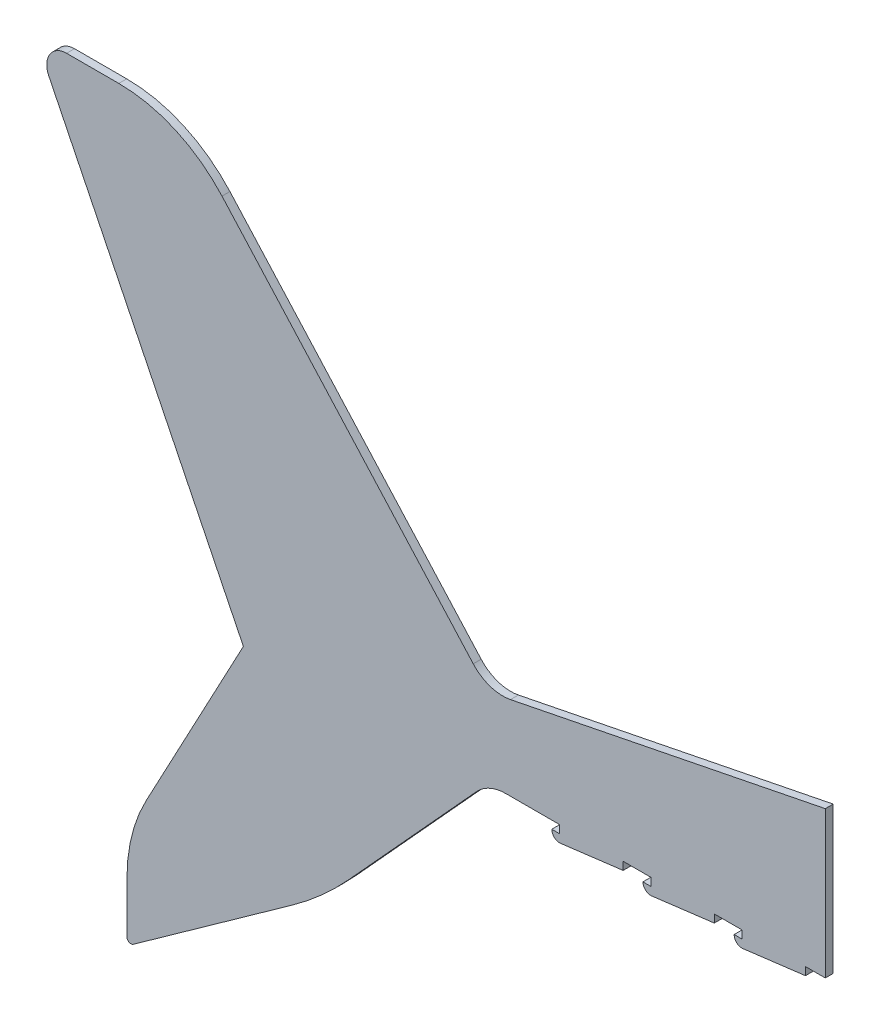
SolidWorks part; units mm, degrees
ref_plane "Front Plane" through (0, 0, 0) normal (0, 0, 1) x (1, 0, 0)
ref_plane "Top Plane" through (0, 0, 0) normal (0, 1, 0) x (1, 0, 0)
ref_plane "Right Plane" through (0, 0, 0) normal (1, 0, 0) x (0, 0, -1)
sketch "Sketch1" plane through (0, 0, 0) normal (0, 0, 1) x (1, 0, 0)
  line L0 (0, 0) -> (-85, 0)
  line L1 (0, 0) -> (0, 37)
  line L2 (0, 37) -> (-85, 20)
  line L4 (-85, 0) -> (-126.771, -45.8169)
  line L5 (-126.771, -45.8169) -> (-176.1556, -81.0577)
  line L6 (-176.1556, -81.0577) -> (-176.1556, -55.9797)
  line L7 (-176.1556, -55.9797) -> (-146.7875, -0.9545)
  line L8 (-146.7875, -0.9545) -> (-199.4076, 106.3241)
  line L9 (-199.4076, 106.3241) -> (-162.6163, 106.3241)
  line L10 (-162.6163, 106.3241) -> (-85, 20)
  dimension "D1" = 85
  dimension "D2" = 37
  dimension "D3" = 20
  dimension "D4" = 62
  dimension "D5" = 126.771
  dimension "D6" = 146.7875
  dimension "D7" = 162.6163
  dimension "D8" = 176.1556
  dimension "D9" = 199.4076
  dimension "D10" = 106.3241
  dimension "D11" = 0.9545
  dimension "D12" = 55.9797
  dimension "D13" = 81.0577
extrude "Boss-Extrude1" add sketch "Sketch1" along normal blind 2
fillet "Fillet1" radius 10 2 edges at (-85, 0, 1) (-85, 20, 1)
fillet "Fillet2" radius 90 1 edges at (-126.771, -45.8169, 1)
fillet "Fillet3" radius 1 1 edges at (-176.1556, -81.0577, 1)
fillet "Fillet4" radius 41 1 edges at (-176.1556, -55.9797, 1)
fillet "Fillet5" radius 5 1 edges at (-199.4076, 106.3241, 1)
fillet "Fillet6" radius 35 1 edges at (-162.6163, 106.3241, 1)
sketch "Sketch2" plane through (0, 0, 0) normal (0, -1, 0) x (1, 0, 0)
  line L0 (-80.5848, 2) -> (0, 2) construction
  line L1 (-5, 2) -> (-21, 2)
  line L2 (-5, 2) -> (-5, 0)
  line L3 (-5, 0) -> (-21, 0)
  line L4 (-21, 2) -> (-21, 0)
  line L5 (-80.5848, 0) -> (0, 0) construction
  dimension "D1" = 5
  dimension "D2" = 16
extrude "Boss-Extrude2" add sketch "Sketch2" along normal blind 2
sketch "Sketch3" plane through (0, 0, 2) normal (0, 0, 1) x (1, 0, 0)
  line L1 (-21, -2) -> (-23, -2)
  line L2 (-21, -4) -> (-5, -2)
  line L3 (-23, -2) -> (-5, -2)
  line L4 (-23, -2) -> (-5, -2)
  line L5 (-21, -2) -> (-5, -2)
  arc A0 (-23, -2) -> (-21, -4) centre (-21, -2) ccw
  dimension "D1" = 2
extrude "Boss-Extrude3" add sketch "Sketch3" against normal blind 2 contours L1 A0 L2 M18
pattern_linear "LPattern1" count 3 spacing 23 along (-1, 0, 0) of "Boss-Extrude3", "Boss-Extrude2"
equation "\"anch\" = 2"
equation "\"alt\" = 100"
equation "\"pilanch\" = 100"
equation "\"pilalt\" = 250"
equation "\"bodyHeigh\" = 60"
equation "\"dorsalFinHeigh\" = 400"
equation "\"D1@Boss-Extrude1\"=\"anch\""
equation "\"D1@Boss-Extrude2\"=\"anch\""
equation "\"D1@Boss-Extrude3\"=\"anch\""
